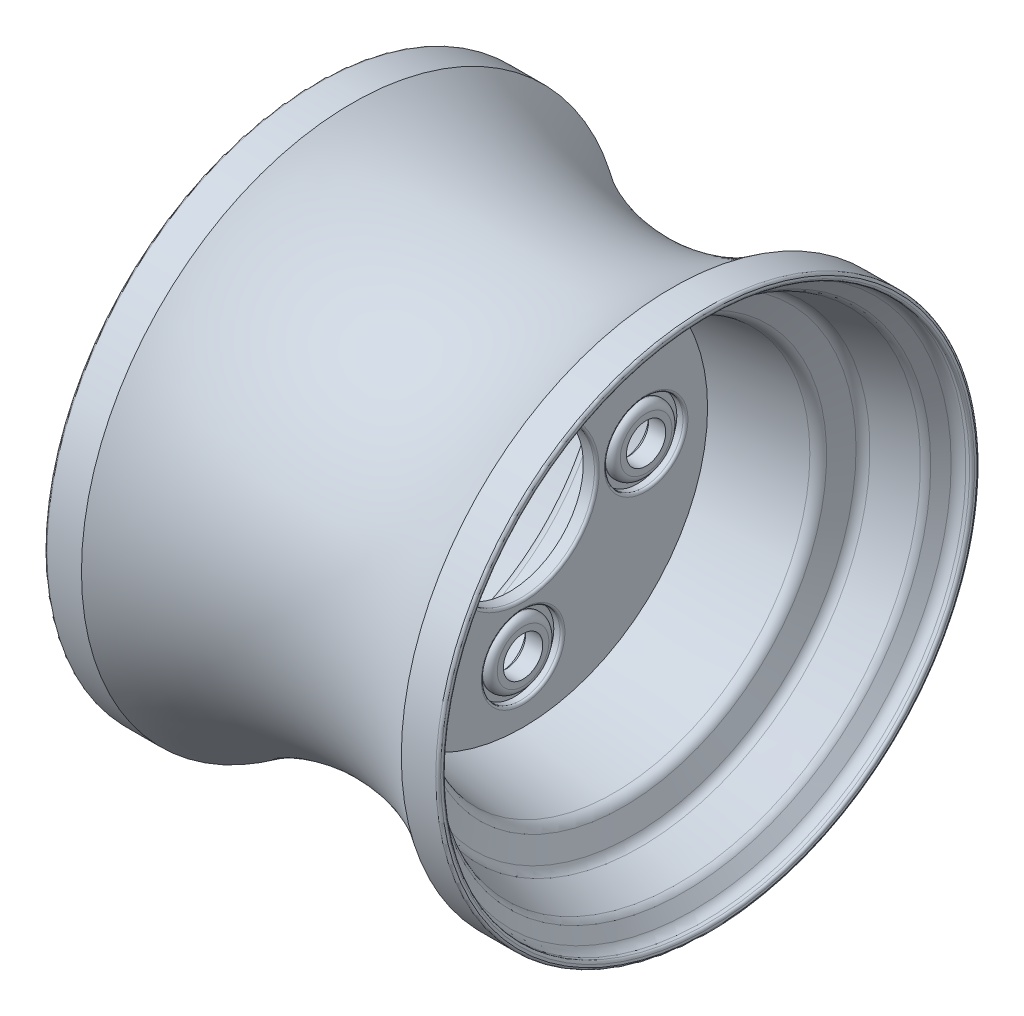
SolidWorks part; units mm, degrees
ref_plane "Ebene vorne" through (0, 0, 0) normal (0, 0, 1) x (1, 0, 0)
ref_plane "Ebene oben" through (0, 0, 0) normal (0, 1, 0) x (1, 0, 0)
ref_plane "Ebene rechts" through (0, 0, 0) normal (1, 0, 0) x (0, 0, -1)
sketch "Skizze1" plane through (0, 0, 0) normal (0, 0, 1) x (1, 0, 0)
  line L0 (-3.5, 30) -> (3.5, 30)
  line L1 (4.5, 31) -> (4.5, 70.5904)
  line L2 (8.875, 75.5512) -> (41.4204, 79.6515)
  line L3 (45.3439, 82.536) -> (49.093, 90.749)
  line L4 (52.0739, 93.4205) -> (67.5038, 98.5151)
  line L5 (79, 107) -> (77.4967, 107)
  line L6 (0, 203.9186) -> (0, -69.5913) construction
  line L7 (-4.5, 31) -> (-4.5, 70.5904)
  line L8 (-8.875, 75.5512) -> (-41.4204, 79.6515)
  line L9 (-45.3439, 82.536) -> (-49.093, 90.749)
  line L10 (-52.0739, 93.4205) -> (-67.5038, 98.5151)
  line L11 (-73.4999, 105.0042) -> (-69.933, 100.2588)
  line L12 (73.4999, 105.0042) -> (69.933, 100.2588)
  line L13 (80, 108) -> (80, 109)
  line L14 (79, 110) -> (65, 110)
  line L15 (-79, 107) -> (-77.4967, 107)
  line L16 (-80, 108) -> (-80, 109)
  line L17 (-79, 110) -> (-65, 110)
  line L18 (-80, 0) -> (158.1713, 0) construction
  line L19 (8.875, 75.5512) -> (4.5, 75)
  line L20 (4.5, 75) -> (4.5, 70.5904)
  line L21 (-8.875, 75.5512) -> (-4.5, 75)
  line L22 (-4.5, 75) -> (-4.5, 70.5904)
  line L23 (8.5, 78.5277) -> (41.0454, 82.628)
  line L24 (42.6148, 83.7818) -> (46.3639, 91.9948)
  line L25 (51.1333, 96.2693) -> (66.5632, 101.3638)
  line L26 (67.5349, 102.0613) -> (71.2517, 107)
  line L27 (-1.5, 77.6458) -> (1.5, 77.6458)
  line L29 (71.2517, 107) -> (65.9357, 107)
  line L30 (-71.2517, 107) -> (-65.9357, 107)
  line L31 (-71.2517, 107) -> (-67.5349, 102.0613)
  line L34 (-51.1333, 96.2693) -> (-66.5632, 101.3638)
  line L35 (-42.6148, 83.7818) -> (-46.3639, 91.9948)
  line L36 (-8.5, 78.5277) -> (-41.0454, 82.628)
  line L37 (-8.5, 78.5277) -> (-1.5, 77.6458)
  line L43 (8.5, 78.5277) -> (1.5, 77.6458)
  line L44 (-71.2517, 107) -> (-71.2517, 107) construction
  line L45 (-71.2517, 107) -> (-71.2517, 107) construction
  line L46 (-71.1018, 106.8067) -> (-67.5349, 102.0613) construction
  line L47 (71.2517, 107) -> (71.2517, 107) construction
  line L48 (71.2517, 107) -> (71.2517, 107) construction
  line L49 (71.1018, 106.8067) -> (67.5349, 102.0613) construction
  line L50 (-1.5, 33) -> (1.5, 33) construction
  line L51 (1.5, 33) -> (1.5, 70.5904) construction
  line L52 (-1.5, 33) -> (-1.5, 70.5904) construction
  line L53 (1.5, 77.6458) -> (1.5, 70.5904) construction
  line L54 (-1.5, 77.6458) -> (-1.5, 70.5904) construction
  arc A0 (-65, 110) -> (65, 110) centre (0, 203.2473) ccw
  arc A1 (42.6148, 83.7818) -> (41.0454, 82.628) centre (40.7954, 84.6123) cw
  arc A2 (45.3439, 82.536) -> (41.4204, 79.6515) centre (40.7954, 84.6123) cw
  arc A3 (52.0739, 93.4205) -> (49.093, 90.749) centre (53.6415, 88.6726) ccw
  arc A4 (69.933, 100.2588) -> (67.5038, 98.5151) centre (65.9362, 103.263) cw
  arc A5 (77.4967, 107) -> (73.4999, 105.0042) centre (77.4967, 102) ccw
  arc A6 (51.1333, 96.2693) -> (46.3639, 91.9948) centre (53.6415, 88.6726) ccw
  arc A7 (-45.3439, 82.536) -> (-41.4204, 79.6515) centre (-40.7954, 84.6123) ccw
  arc A8 (-52.0739, 93.4205) -> (-49.093, 90.749) centre (-53.6415, 88.6726) cw
  arc A9 (-69.933, 100.2588) -> (-67.5038, 98.5151) centre (-65.9362, 103.263) ccw
  arc A10 (-77.4967, 107) -> (-73.4999, 105.0042) centre (-77.4967, 102) cw
  arc A11 (80, 108) -> (79, 107) centre (79, 108) cw
  arc A12 (79, 110) -> (80, 109) centre (79, 109) cw
  arc A13 (-80, 108) -> (-79, 107) centre (-79, 108) ccw
  arc A14 (-79, 110) -> (-80, 109) centre (-79, 109) ccw
  arc A15 (4.5, 31) -> (3.5, 30) centre (3.5, 31) cw
  arc A16 (-4.5, 31) -> (-3.5, 30) centre (-3.5, 31) ccw
  arc A17 (67.5349, 102.0613) -> (66.5632, 101.3638) centre (65.9362, 103.263) cw
  arc A21 (-65.9357, 107) -> (65.9357, 107) centre (0, 203.2473) ccw
  arc A25 (-67.5349, 102.0613) -> (-66.5632, 101.3638) centre (-65.9362, 103.263) ccw
  arc A26 (-51.1333, 96.2693) -> (-46.3639, 91.9948) centre (-53.6415, 88.6726) cw
  arc A27 (-42.6148, 83.7818) -> (-41.0454, 82.628) centre (-40.7954, 84.6123) ccw
  arc A30 (-71.2517, 107) -> (-71.2517, 107) centre (-71.2517, 107) ccw construction
  arc A31 (-71.2517, 107) -> (-71.2517, 107) centre (-71.2517, 107) ccw construction
  arc A32 (-71.2517, 107) -> (-71.1018, 106.8067) centre (-77.4967, 102) cw construction
  arc A33 (71.2517, 107) -> (71.1018, 106.8067) centre (77.4967, 102) ccw construction
  arc A34 (71.2517, 107) -> (71.2517, 107) centre (71.2517, 107) cw construction
  arc A35 (71.2517, 107) -> (71.2517, 107) centre (71.2517, 107) cw construction
  arc A36 (-1.5, 33) -> (-1.5, 33) centre (-1.5, 33) ccw construction
  arc A37 (1.5, 33) -> (1.5, 33) centre (1.5, 33) cw construction
  point P26 (4.5, 75)
  point P29 (44.1863, 80)
  point P32 (50, 92.7358)
  point P35 (68.9916, 99.0063)
  point P38 (75, 107)
  point P41 (-4.5, 75)
  point P44 (-44.1863, 80)
  point P47 (-50, 92.7358)
  point P50 (-68.9916, 99.0063)
  point P53 (-75, 107)
  point P56 (80, 107)
  point P59 (80, 110)
  point P62 (-80, 107)
  point P65 (-80, 110)
  point P68 (4.5, 30)
  point P71 (-4.5, 30)
  dimension "D16" = 3
  dimension "D17" = 1
  dimension "D1" = 9
  dimension "D2" = 4.5
  dimension "D3" = 3
  dimension "D4" = 40
  dimension "D5" = 75
  dimension "D6" = 80
  dimension "D7" = 14
  dimension "D8" = 50
  dimension "D9" = 20
  dimension "D10" = 10
  dimension "D11" = 110
  dimension "D12" = 15
  dimension "D13" = 80
  dimension "D14" = 5
  dimension "D15" = 30
revolve "Rotation1" add sketch "Skizze1" angle 360 about L18
sketch "Skizze2" plane through (-4.5, 0, 0) normal (-1, 0, 0) x (0, 0, 1)
  line L0 (0, 68.0364) -> (0, -61.4083) construction
  line L1 (-51.9716, 0) -> (57.7968, 0) construction
  circle A0 centre (0, 50) radius 8
  circle A1 centre (0, -50) radius 8
  circle A2 centre (-50, 0) radius 8
  circle A3 centre (50, 0) radius 8
  dimension "D1" = 50
extrude "Schnitt-Linear austragen1" cut sketch "Skizze2" against normal through all
sketch "Skizze3" plane through (-4.5, 0, 0) normal (-1, 0, 0) x (0, 0, 1)
  circle A0 centre (-50, 0) radius 16
  circle A1 centre (0, 50) radius 16
  circle A2 centre (50, 0) radius 16
  circle A3 centre (0, -50) radius 16
  circle A4 centre (0, 0) radius 75
  circle A5 centre (0, 0) radius 30
extrude "Schnitt-Linear austragen2" cut sketch "Skizze3" against normal blind 3.5
fillet "Verrundung1" radius 5 4 edges at (-4.5, 0, 66) (-4.5, -50, 16) (-4.5, 0, -34) (-4.5, 50, 16)
fillet "Verrundung2" radius 2 1 edges at (-1, 0, 75)
chamfer "Fase1" distance 2 angle 45 4 edges at (-4.5, 0, -42) (-4.5, -50, -8) (-4.5, 0, 42) (-4.5, 50, 8)
sketch "Skizze4" plane through (4.5, 0, 0) normal (1, 0, 0) x (0, 0, -1)
  circle A0 centre (0, 50) radius 16
  circle A1 centre (50, 0) radius 16
  circle A2 centre (0, -50) radius 16
  circle A3 centre (-50, 0) radius 16
  circle A4 centre (-50, 0) radius 13.5
  circle A5 centre (0, 50) radius 13.5
  circle A6 centre (50, 0) radius 13.5
  circle A7 centre (0, -50) radius 13.5
extrude "Schnitt-Linear austragen3" cut sketch "Skizze4" against normal blind 3.5
fillet "Verrundung3" radius 1 4 edges at (4.5, -50, -16) (4.5, 0, 34) (4.5, 0, -66) (4.5, 50, -16)
fillet "Verrundung4" radius 3 4 edges at (4.5, 50, -13.5) (4.5, 0, -63.5) (4.5, -50, -13.5) (4.5, 0, 36.5)
sketch "Skizze5" plane through (-80, 0, 0) normal (-1, 0, 0) x (0, 0, 1)
  line L0 (0, 0) -> (0, -159.9229) construction
  line L2 (-100, -68.6488) -> (100, -68.6488)
  line L3 (-100, -68.6488) -> (-100, -118.6488)
  line L4 (-100, -118.6488) -> (100, -118.6488)
  line L5 (100, -68.6488) -> (100, -118.6488)
  dimension "D1" = 200
  dimension "D2" = 100
  dimension "D3" = 50
extrude "Schnitt-Linear austragen4" cut sketch "Skizze5" against normal blind 0.0001
